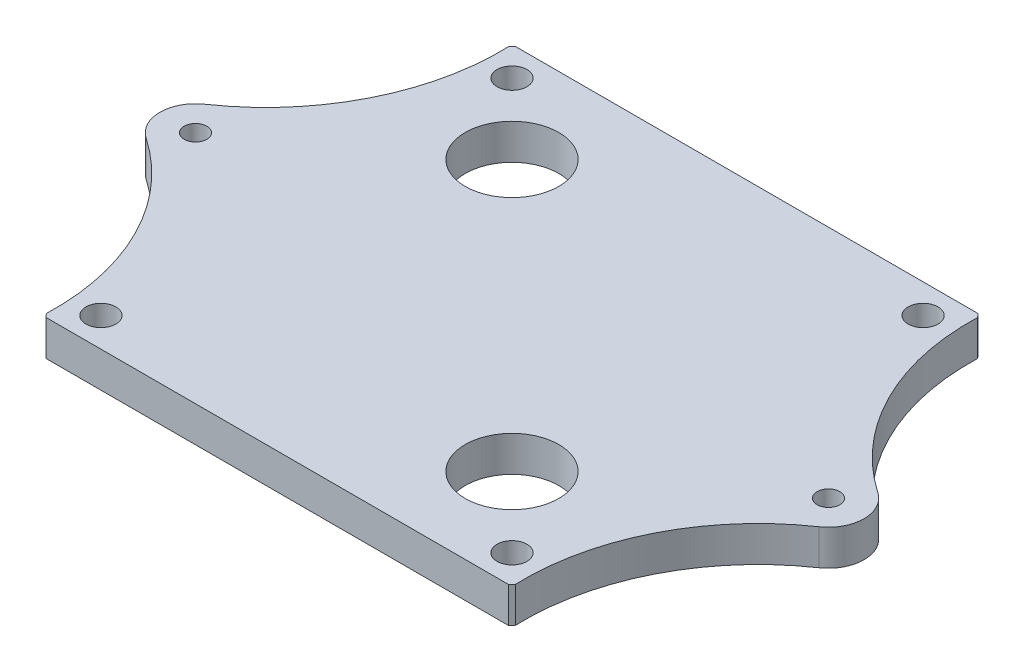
SolidWorks part; units mm, degrees
ref_plane "Ebene vorne" through (0, 0, 0) normal (0, 0, 1) x (1, 0, 0)
ref_plane "Ebene oben" through (0, 0, 0) normal (0, 1, 0) x (1, 0, 0)
ref_plane "Ebene rechts" through (0, 0, 0) normal (1, 0, 0) x (0, 0, -1)
sketch "Skizze1" plane through (0, 0, 0) normal (0, 1, 0) x (1, 0, 0)
  line L0 (33, 33) -> (-33, -33) construction
  line L1 (-33, 33) -> (33, 33)
  line L2 (-33, 33) -> (-33, -33) construction
  line L3 (-33, -33) -> (33, -33)
  line L4 (33, 33) -> (33, -33) construction
  line L5 (0, 0) -> (0, -20.4462) construction
  arc A0 (-47.3236, 4.1264) -> (-47.3236, -4.1264) centre (-44.5, 0) ccw
  arc A1 (-47.3236, 4.1264) -> (-33, 33) centre (-65.9593, 31.3608) ccw
  arc A2 (-33, -33) -> (-47.3236, -4.1264) centre (-65.9593, -31.3608) ccw
  arc A3 (47.3236, 4.1264) -> (33, 33) centre (65.9593, 31.3608) cw
  arc A4 (47.3236, 4.1264) -> (47.3236, -4.1264) centre (44.5, 0) cw
  arc A5 (33, -33) -> (47.3236, -4.1264) centre (65.9593, -31.3608) cw
  dimension "D3" = 10
  dimension "D4" = 66
  dimension "D1" = 66
  dimension "D2" = 66
  dimension "D5" = 44.5
extrude "Linear austragen1" add sketch "Skizze1" along normal blind 5
sketch "Skizze2" plane through (0, 5, 0) normal (0, 1, 0) x (-1, 0, 0)
  line L0 (0, 0) -> (0, 11.7511) construction
  circle A0 centre (44.5, 0) radius 1.6
  circle A1 centre (-44.5, 0) radius 1.6
  dimension "D1" = 89
  dimension "D2" = 3.2
extrude "Schnitt-Linear austragen1" cut sketch "Skizze2" against normal blind 5
sketch "Skizze4" plane through (0, 5, 0) normal (0, 1, 0) x (-1, 0, 0)
  line L0 (-28.9, -28.9) -> (28.9, 28.9) construction
  circle A0 centre (28.9, -28.9) radius 2.1
  circle A1 centre (-28.9, -28.9) radius 2.1
  circle A2 centre (-28.9, 28.9) radius 2.1
  circle A3 centre (28.9, 28.9) radius 2.1
  dimension "D3" = 4.2
  dimension "D1" = 57.8
  dimension "D2" = 57.8
extrude "Schnitt-Linear austragen2" cut sketch "Skizze4" against normal blind 5
chamfer "Fase1" distance 0.5 angle 45 4 edges at (-33, 2.5, -33) (33, 2.5, -33) (33, 2.5, 33) (-33, 2.5, 33)
hole_wizard "G1/4 Gewindekernloch3" positions "Skizze14" profile "Skizze13" tap size "G1/4" standard "DIN"
sketch "Skizze14" plane through (0, 5, 0) normal (0, 1, 0) x (-1, 0, 0)
  point P0 (-19, 19)
  point P1 (19, -19)
  dimension "D1" = 19
  dimension "D2" = 19
  dimension "D3" = 38
  dimension "D4" = 38
sketch "Skizze13" plane through (19, 5, 19) normal (1, 0, 0) x (0, 0, 1)
  line L0 (0, 0) -> (0, 33.7634)
  line L1 (0, 33.7634) -> (5.7225, 30.325)
  line L2 (5.7225, 30.325) -> (5.7225, 26.314)
  line L3 (5.7225, 26.314) -> (6.5785, 26.314)
  line L4 (6.5785, 26.314) -> (6.5785, 0)
  line L5 (6.5785, 0) -> (0, 0)
  line L10 (0, 33.7634) -> (-5.7225, 30.325) construction
  line L11 (0, -6.35) -> (0, 107.95) construction
  dimension "Bohrerdurchmesser" = 11.445
  dimension "Bohrungstiefe" = 30.325
  dimension "Nenndurchmesser" = 13.157
  dimension "Gewindelänge" = 26.314
  dimension "Spitzenwinkel" = 118
